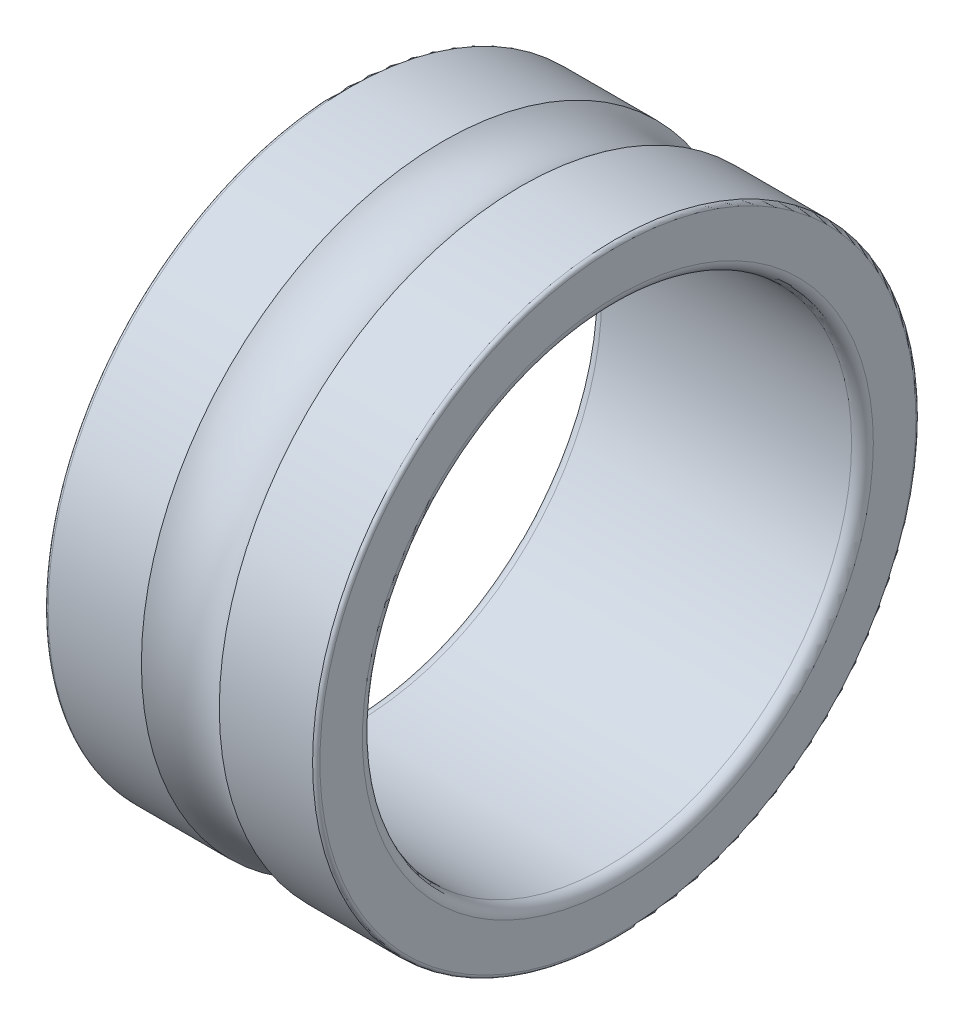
SolidWorks part; units mm, degrees
ref_plane "Front Plane" through (0, 0, 0) normal (0, 0, 1) x (1, 0, 0)
ref_plane "Top Plane" through (0, 0, 0) normal (0, 1, 0) x (1, 0, 0)
ref_plane "Right Plane" through (0, 0, 0) normal (1, 0, 0) x (0, 0, -1)
ref_plane "Plane4" through (0, 0, 0) normal (0, 0, 1) x (1, 0, 0)
sketch "Sketch1" plane through (0, 0, 0) normal (0, 0, 1) x (1, 0, 0)
  line L0 (0.2, 4.5) -> (4.8, 4.5)
  line L1 (5, 4.7) -> (5, 5.483)
  line L2 (4.933, 5.55) -> (3.2167, 5.55)
  line L3 (1.7833, 5.55) -> (0.067, 5.55)
  line L4 (0, 5.483) -> (0, 4.7)
  line L5 (50, 0) -> (-50, 0) construction
  arc A0 (0, 4.7) -> (0.2, 4.5) centre (0.2, 4.7) ccw
  arc A1 (4.8, 4.5) -> (5, 4.7) centre (4.8, 4.7) ccw
  arc A2 (5, 5.483) -> (4.933, 5.55) centre (4.933, 5.483) ccw
  arc A3 (3.2167, 5.55) -> (1.7833, 5.55) centre (2.5, 6.5) cw
  arc A4 (0.067, 5.55) -> (0, 5.483) centre (0.067, 5.483) ccw
  dimension "D4" = 1.19
  dimension "D5" = 0.95
  dimension "D1" = 4.5
  dimension "D2" = 1.05
  dimension "D3" = 5
  dimension "D6" = 2.5
revolve "Revolve1" add sketch "Sketch1" angle 360 about L5
